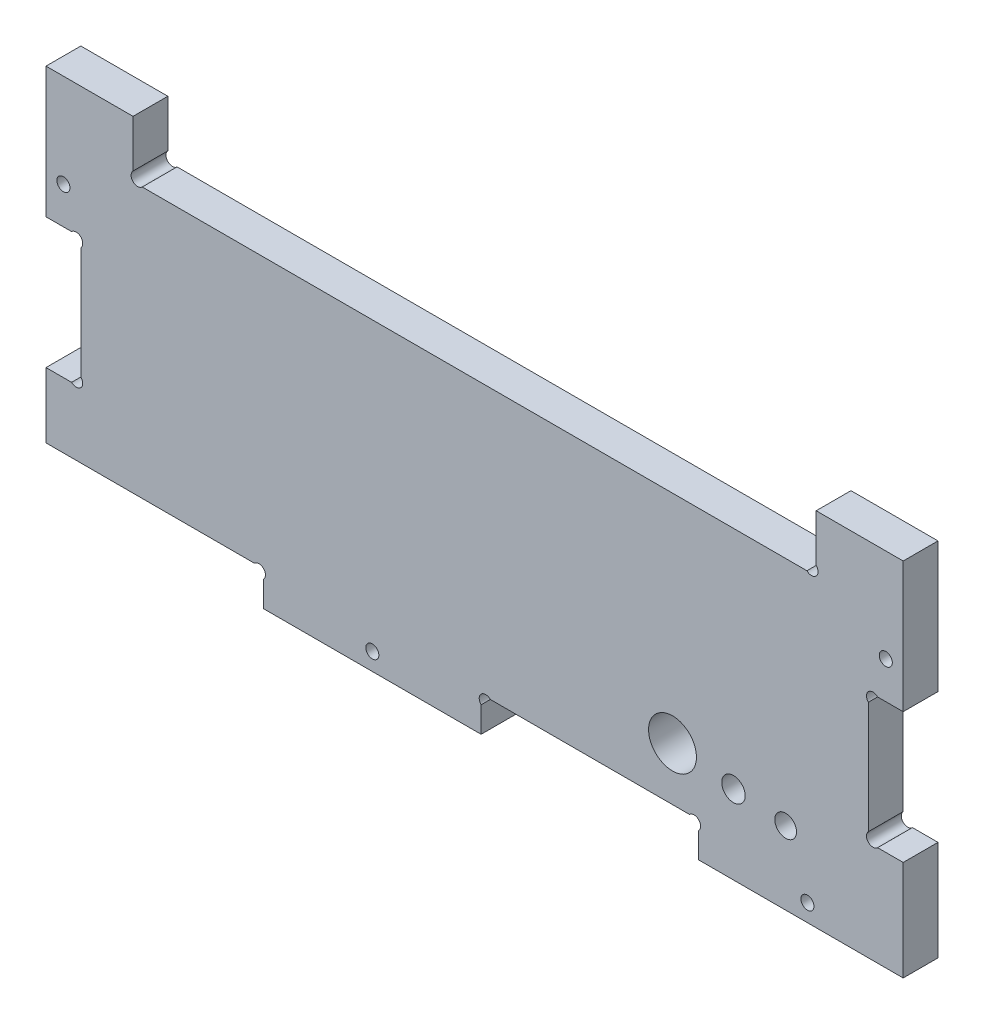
SolidWorks part; units mm, degrees
ref_plane "Plan de face" through (0, 0, 0) normal (0, 0, 1) x (1, 0, 0)
ref_plane "Plan de dessus" through (0, 0, 0) normal (0, 1, 0) x (1, 0, 0)
ref_plane "Plan de droite" through (0, 0, 0) normal (1, 0, 0) x (0, 0, -1)
sketch "Esquisse1" plane through (0, 0, 0) normal (0, 0, 1) x (1, 0, 0)
  line L0 (-176.8157, 28.3831) -> (-176.8157, 45.3831)
  line L1 (20.1843, 45.3831) -> (20.1843, 58.3831)
  line L2 (-176.8157, -16.6169) -> (-176.8157, -1.6169)
  line L3 (20.1843, -1.6169) -> (14.3056, -1.6169)
  line L4 (12.1843, 0.5044) -> (12.1843, 26.2618)
  line L5 (14.3056, 28.3831) -> (20.1843, 28.3831)
  line L6 (20.1843, 28.3831) -> (20.1843, 45.3831)
  line L7 (-1.937, 45.3831) -> (-154.6944, 45.3831)
  line L8 (20.1843, 45.3831) -> (12.1843, 28.3831) construction
  line L9 (20.1843, -18.7382) -> (20.1843, -24.6169)
  line L10 (-126.8157, -24.6169) -> (-76.8157, -16.6169) construction
  line L11 (-176.8157, -24.6169) -> (-126.8157, -24.6169) construction
  line L12 (20.1843, -24.6169) -> (-26.8157, -24.6169)
  line L13 (-26.8157, -24.6169) -> (-26.8157, -18.7382)
  line L14 (-74.6944, -16.6169) -> (-28.937, -16.6169)
  line L15 (-26.8157, -24.6169) -> (23.1843, -16.6169) construction
  line L16 (-76.8157, -18.7382) -> (-76.8157, -24.6169)
  line L17 (-76.8157, -24.6169) -> (-126.8157, -24.6169)
  line L18 (-126.8157, -24.6169) -> (-126.8157, -18.7382)
  line L19 (-128.937, -16.6169) -> (-176.8157, -16.6169)
  line L20 (-176.8157, 28.3831) -> (-168.8157, 45.3831) construction
  line L21 (0.1843, 45.3831) -> (-14.5022, 60.0697) construction
  line L22 (12.1843, 28.3831) -> (18.2063, 22.3612) construction
  line L23 (-156.8157, 45.3831) -> (-140.8116, 61.3872) construction
  line L25 (-176.8157, -1.6169) -> (-170.937, -1.6169)
  line L27 (-168.8157, 0.5044) -> (-168.8157, 26.2618)
  line L28 (-170.937, 28.3831) -> (-176.8157, 28.3831)
  line L29 (20.1843, -18.7382) -> (20.1843, -1.6169)
  line L31 (20.1843, 58.3831) -> (0.1843, 58.3831)
  line L32 (0.1843, 58.3831) -> (0.1843, 47.5044)
  line L33 (12.1843, -1.6169) -> (19.1626, 5.3614) construction
  line L34 (-176.8157, 45.3831) -> (-176.8157, 58.3831)
  line L35 (-176.8157, 58.3831) -> (-156.8157, 58.3831)
  line L36 (-156.8157, 58.3831) -> (-156.8157, 47.5044)
  circle A0 centre (-32.8343, -4.4269) radius 5.5
  arc A1 (-126.8157, -18.7382) -> (-128.937, -16.6169) centre (-127.8763, -17.6775) ccw
  arc A2 (-74.6944, -16.6169) -> (-76.8157, -18.7382) centre (-75.755, -17.6775) ccw
  arc A3 (-26.8157, -18.7382) -> (-28.937, -16.6169) centre (-27.8763, -17.6775) ccw
  circle A4 centre (-18.818, -6.5169) radius 2.7
  arc A5 (-170.937, -1.6169) -> (-168.8157, 0.5044) centre (-169.8763, -0.5562) ccw
  arc A6 (-168.8157, 26.2618) -> (-170.937, 28.3831) centre (-169.8763, 27.3225) ccw
  circle A7 centre (-6.8287, -7.8169) radius 2.5
  circle A8 centre (16.1843, 36.8831) radius 1.5
  circle A9 centre (-101.8157, -20.6169) radius 1.5
  circle A10 centre (-1.8157, -20.6169) radius 1.5
  circle A11 centre (-172.8157, 36.8831) radius 1.5
  arc A12 (-1.937, 45.3831) -> (0.1843, 47.5044) centre (-0.8763, 46.4438) ccw
  arc A13 (-156.8157, 47.5044) -> (-154.6944, 45.3831) centre (-155.755, 46.4438) ccw
  arc A14 (14.3056, 28.3831) -> (12.1843, 26.2618) centre (13.245, 27.3225) ccw
  arc A16 (12.1843, 0.5044) -> (14.3056, -1.6169) centre (13.245, -0.5562) ccw
  dimension "D1" = 50
  dimension "D8" = 45
  dimension "D10" = 8
  dimension "D2" = 45
  dimension "D5" = 45
  dimension "D3" = 45
  dimension "D6" = 47
  dimension "D7" = 50
  dimension "D11" = 20
  dimension "D12" = 20
extrude "Boss.-Extru.1" add sketch "Esquisse1" along normal blind 8
